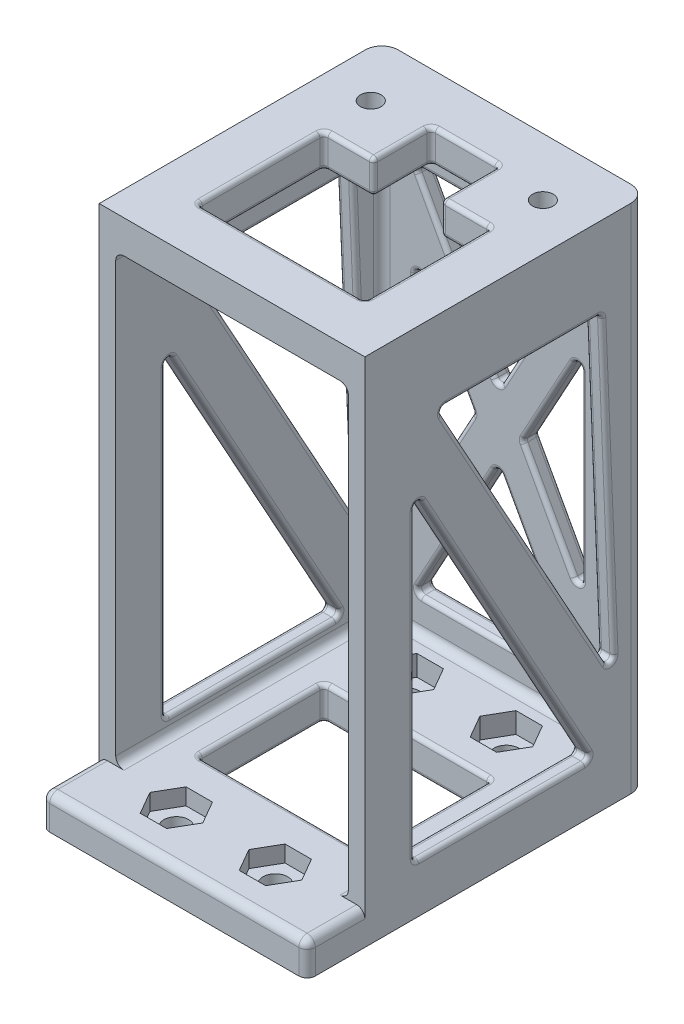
SolidWorks part; units mm, degrees
ref_plane "Front Plane" through (0, 0, 0) normal (0, 0, 1) x (1, 0, 0)
ref_plane "Top Plane" through (0, 0, 0) normal (0, 1, 0) x (1, 0, 0)
ref_plane "Right Plane" through (0, 0, 0) normal (1, 0, 0) x (0, 0, -1)
sketch "Sketch1" plane through (0, 0, 0) normal (0, 1, 0) x (1, 0, 0)
  line L1 (0, 0) -> (32.2, 0)
  line L2 (0, 0) -> (0, 34.25)
  line L3 (0, 34.25) -> (32.2, 34.25)
  line L4 (32.2, 0) -> (32.2, 34.25)
  dimension "D1" = 34.25
  dimension "D2" = 32.2
extrude "Boss-Extrude1" add sketch "Sketch1" along normal blind 4
sketch "Sketch2" plane through (0, 4, 0) normal (0, 1, 0) x (1, 0, 0)
  line L0 (32.2, 34.25) -> (0, 34.25) construction
  line L3 (16.1, 27.25) -> (10.1, 27.25) construction
  line L4 (16.1, 27.25) -> (22.1, 27.25) construction
  line L5 (16.1, 34.25) -> (16.1, 0) construction
  line L6 (0, 0) -> (32.2, 0) construction
  dimension "D1" = 6
  dimension "D2" = 7
ref_plane "Plane1" through (0, 58, 0) normal (0, 1, 0) x (1, 0, 0)
sketch "Sketch5" plane through (0, 58, 0) normal (0, 1, 0) x (1, 0, 0)
  line L1 (0, 34.25) -> (32.2, 34.25)
  line L2 (0, 34.25) -> (0, 0)
  line L3 (0, 0) -> (32.2, 0)
  line L4 (32.2, 34.25) -> (32.2, 0)
  dimension "D1" = 34.25
extrude "Boss-Extrude2" add sketch "Sketch5" along normal blind 4 separate body
sketch "Sketch6" plane through (0, 62, 0) normal (0, 1, 0) x (1, 0, 0)
  line L0 (16.1, 34.25) -> (16.1, 0) construction
  line L1 (32.2, 34.25) -> (0, 34.25) construction
  line L2 (0, 0) -> (32.2, 0) construction
  line L3 (16.1, 27.25) -> (5.67, 27.25) construction
  line L4 (16.1, 27.25) -> (26.53, 27.25) construction
  dimension "D1" = 10.43
  dimension "D2" = 7
sketch "Sketch11" plane through (0, 0, 0) normal (-1, 0, 0) x (0, 0, 1)
  line L0 (-34.25, 4) -> (-34.25, 58)
  line L1 (-34.25, 58) -> (0, 58)
  line L2 (0, 58) -> (0, 4)
  line L3 (0, 4) -> (-34.25, 4)
  line L4 (-34.25, 31) -> (0, 31) construction
extrude "Boss-Extrude3" add sketch "Sketch11" against normal blind 2
sketch "Sketch13" plane through (0, 0, 0) normal (-1, 0, 0) x (0, 0, 1)
  line L0 (-28.6924, 52) -> (-8.9515, 52)
  line L1 (-6, 44.9345) -> (-6, 6)
  line L2 (-6, 6) -> (-27.5082, 6)
  line L5 (-34.25, 62) -> (0, 62) construction
  line L6 (0, 62) -> (0, 0) construction
  line L7 (-34.25, 0) -> (0, 0) construction
  line L8 (17.71, 58) -> (-17.71, 58) construction
  line L9 (-30.2834, 13.3846) -> (-8.9515, 52)
  line L10 (-6, 44.9345) -> (-27.5082, 6)
  line L11 (0, 62) -> (-34.25, 0) construction
  line L12 (-30.2834, 13.3846) -> (-28.6924, 52)
  dimension "D1" = 6
  dimension "D2" = 6
  dimension "D4" = 6
  dimension "D5" = 3
  dimension "D6" = 3
extrude "Cut-Extrude1" cut sketch "Sketch13" against normal up to next
pattern_linear "LPattern1" count 2 spacing 30.2 along (1, 0, 0) of "Boss-Extrude3", "Cut-Extrude1"
sketch "Sketch16" plane through (0, 62, 0) normal (0, 1, 0) x (1, 0, 0)
  line L0 (12, 21.25) -> (6, 21.25)
  line L1 (26.2, 6) -> (6, 6)
  line L2 (26.2, 6) -> (26.2, 21.25)
  line L3 (26.2, 21.25) -> (20.2, 21.25)
  line L4 (6, 6) -> (6, 21.25)
  line L6 (20.2, 21.25) -> (20.2, 28.25)
  line L7 (20.2, 28.25) -> (12, 28.25)
  line L8 (12, 21.25) -> (12, 28.25)
  line L9 (32.2, 0) -> (32.2, 34.25) construction
  line L10 (0, 0) -> (32.2, 0) construction
  line L11 (0, 34.25) -> (0, 0) construction
  line L13 (32.2, 34.25) -> (0, 34.25) construction
  dimension "D1" = 6
  dimension "D2" = 6
  dimension "D3" = 6
  dimension "D4" = 6
  dimension "D5" = 6
  dimension "D6" = 6
  dimension "D7" = 6
  dimension "D8" = 6
extrude "Cut-Extrude3" cut sketch "Sketch16" against normal up to next
sketch "Sketch17" plane through (0, 0, 0) normal (0, -1, 0) x (1, 0, 0)
  line L0 (16.1, -21.25) -> (6, -21.25)
  line L1 (26.2, -6) -> (6, -6)
  line L2 (26.2, -6) -> (26.2, -21.25)
  line L3 (26.2, -21.25) -> (16.1, -21.25)
  line L4 (6, -6) -> (6, -21.25)
  line L9 (0, 0) -> (32.2, 0) construction
  line L10 (32.2, 0) -> (32.2, -34.25) construction
  line L11 (0, -34.25) -> (0, 0) construction
  line L13 (32.2, -34.25) -> (0, -34.25) construction
  dimension "D1" = 6
  dimension "D2" = 6
  dimension "D3" = 6
  dimension "D4" = 13
extrude "Cut-Extrude4" cut sketch "Sketch17" against normal up to next
sketch "Sketch18" plane through (2, 0, 0) normal (1, 0, 0) x (0, 0, -1)
  line L0 (34.25, 4) -> (32.25, 4)
  line L1 (34.25, 4) -> (0, 4) construction
  line L2 (32.25, 4) -> (32.25, 58)
  line L3 (0, 58) -> (34.25, 58) construction
  line L4 (32.25, 58) -> (34.25, 58)
  line L5 (34.25, 58) -> (34.25, 4)
  dimension "D1" = 2
extrude "Boss-Extrude5" add sketch "Sketch18" along normal up to next
sketch "Sketch19" plane through (0, 0, -34.25) normal (0, 0, -1) x (-1, 0, 0)
  line L0 (-16.1, 54.8836) -> (-16.1, 0.6881) construction
  line L3 (-32.2, 30.4346) -> (0, 30.4346) construction
  line L4 (-32.2, 62) -> (-32.2, 0) construction
  line L5 (0, 62) -> (0, 0) construction
  line L6 (-26.2, 52.8692) -> (-6, 52.8692)
  line L7 (-16.1, 52.8692) -> (-16.1, 34.4346) construction
  line L8 (-16.1, 34.4346) -> (-26.2, 52.8692)
  line L9 (-32.2, 62) -> (0, 62) construction
  line L10 (-16.1, 34.4346) -> (-6, 52.8692)
  line L11 (-16.1, 26.4346) -> (-26.2, 8)
  line L12 (-26.2, 8) -> (-6, 8)
  line L13 (-16.1, 26.4346) -> (-6, 8)
  line L14 (-6, 43.3984) -> (-6, 17.4708)
  line L15 (-6, 43.3984) -> (-13.1026, 30.4346)
  line L16 (-6, 17.4708) -> (-13.1026, 30.4346)
  line L17 (-26.2, 43.3984) -> (-19.0974, 30.4346)
  line L18 (-26.2, 17.4708) -> (-19.0974, 30.4346)
  line L19 (-26.2, 43.3984) -> (-26.2, 17.4708)
  line L21 (-30.2, 4) -> (-2, 4) construction
  line L22 (0, 62) -> (0, 0) construction
  line L23 (-32.2, 0) -> (0, 0) construction
  point P24 (-16.1, 27.7858)
  point P26 (-6, 30.4346)
  dimension "D1" = 6
  dimension "D2" = 9.1308
  dimension "D3" = 6
  dimension "D4" = 4
  dimension "D5" = 4
  dimension "D6" = 4
  dimension "D7" = 0.6881
  dimension "D8" = 7.1164
  dimension "D9" = 16.1
extrude "Cut-Extrude5" cut sketch "Sketch19" against normal up to next
fillet "Fillet9" radius 0.5 108 edges at (26.2, 62, -13.625) (26.2, 58, -13.625) (6, 58, -13.625) (6, 62, -13.625) (12, 58, -24.75) (12, 62, -24.75) (20.2, 62, -24.75) (20.2, 58, -24.75) (26.2, 4, -13.625) (26.2, 0, -13.625) (6, 0, -13.625) (6, 4, -13.625) (2, 6, -16.7541) (0, 6, -16.7541) (0, 25.4672, -6) (2, 25.4672, -6) (2, 52, -18.822) (0, 52, -18.822) (0, 32.6923, -29.4879) (2, 32.6923, -29.4879) (32.2, 6, -16.7541) (30.2, 6, -16.7541) (30.2, 25.4672, -6) (32.2, 25.4672, -6) (32.2, 52, -18.822) (30.2, 52, -18.822) (30.2, 32.6923, -29.4879) (32.2, 32.6923, -29.4879) (22.6487, 23.9527, -32.25) (22.6487, 23.9527, -34.25) (22.6487, 36.9165, -34.25) (22.6487, 36.9165, -32.25) (9.5513, 36.9165, -32.25) (9.5513, 36.9165, -34.25) (9.5513, 23.9527, -34.25) (9.5513, 23.9527, -32.25) (21.15, 43.6519, -32.25) (21.15, 43.6519, -34.25) (11.05, 43.6519, -34.25) (11.05, 43.6519, -32.25) (11.05, 17.2173, -32.25) (11.05, 17.2173, -34.25) (21.15, 17.2173, -34.25) (21.15, 17.2173, -32.25) (26.2, 60, -6) (16.1, 62, -6) (6, 60, -6) (16.1, 58, -6) (20.2, 60, -21.25) (23.2, 62, -21.25) (26.2, 60, -21.25) (23.2, 58, -21.25) (6, 60, -21.25) (9, 62, -21.25) (12, 60, -21.25) (9, 58, -21.25) (12, 60, -28.25) (16.1, 62, -28.25) (20.2, 60, -28.25) (16.1, 58, -28.25) (6, 2, -6) (16.1, 0, -6) (26.2, 2, -6) (16.1, 4, -6) (26.2, 2, -21.25) (16.1, 0, -21.25) (16.1, 4, -21.25) (6, 2, -21.25) (1, 6, -27.5082) (0, 25.4672, -16.7541) (1, 44.9345, -6) (2, 25.4672, -16.7541) (1, 52, -8.9515) (0, 32.6923, -19.6175) (1, 13.3846, -30.2834) (2, 32.6923, -19.6175) (31.2, 6, -27.5082) (30.2, 25.4672, -16.7541) (31.2, 44.9345, -6) (32.2, 25.4672, -16.7541) (31.2, 52, -8.9515) (30.2, 32.6923, -19.6175) (31.2, 13.3846, -30.2834) (32.2, 32.6923, -19.6175) (26.2, 17.4708, -33.25) (26.2, 30.4346, -34.25) (26.2, 43.3984, -33.25) (26.2, 30.4346, -32.25) (6, 43.3984, -33.25) (6, 30.4346, -34.25) (6, 17.4708, -33.25) (6, 30.4346, -32.25) (26.2, 52.8692, -33.25) (16.1, 52.8692, -34.25) (6, 52.8692, -33.25) (16.1, 52.8692, -32.25) (6, 8, -33.25) (16.1, 8, -34.25) (26.2, 8, -33.25) (16.1, 8, -32.25) (1, 6, -6) (1, 52, -28.6924) (31.2, 6, -6) (31.2, 52, -28.6924) (19.0974, 30.4346, -33.25) (13.1026, 30.4346, -33.25) (16.1, 26.4346, -33.25) (16.1, 34.4346, -33.25)
fillet "Fillet10" radius 1 8 edges at (30.2, 58, -16.125) (2, 58, -16.125) (16.1, 58, -32.25) (30.2, 4, -16.125) (30.2, 31, -32.25) (2, 31, -32.25) (2, 4, -16.125) (16.1, 4, -32.25)
fillet "Fillet11" radius 2 2 edges at (32.2, 31, -34.25) (0, 31, -34.25)
sketch "Sketch20" plane through (0, 4, 0) normal (0, 1, 0) x (1, 0, 0)
  circle A0 centre (10.1, 27.25) radius 1.5
  circle A1 centre (22.1, 27.25) radius 1.5
  dimension "D1" = 3
extrude "Cut-Extrude6" cut sketch "Sketch20" against normal blind 10
sketch "Sketch21" plane through (0, 62, 0) normal (0, 1, 0) x (1, 0, 0)
  circle A0 centre (5.67, 27.25) radius 1.25
  circle A1 centre (26.53, 27.25) radius 1.25
  dimension "D1" = 2.5
extrude "Cut-Extrude7" cut sketch "Sketch21" against normal up to next
sketch "Sketch22" plane through (0, 4, 0) normal (0, 1, 0) x (1, 0, 0)
  line L1 (13.3043, 27.25) -> (11.7021, 30.025)
  line L2 (11.7021, 30.025) -> (8.4979, 30.025)
  line L3 (8.4979, 30.025) -> (6.8957, 27.25)
  line L4 (6.8957, 27.25) -> (8.4979, 24.475)
  line L5 (8.4979, 24.475) -> (11.7021, 24.475)
  line L6 (11.7021, 24.475) -> (13.3043, 27.25)
  line L7 (18.8957, 27.25) -> (20.4979, 24.475)
  line L8 (20.4979, 24.475) -> (23.7021, 24.475)
  line L9 (23.7021, 24.475) -> (25.3043, 27.25)
  line L10 (25.3043, 27.25) -> (23.7021, 30.025)
  line L11 (23.7021, 30.025) -> (20.4979, 30.025)
  line L12 (20.4979, 30.025) -> (18.8957, 27.25)
  line L13 (30.2, 34.25) -> (2, 34.25) construction
  circle A0 centre (10.1, 27.25) radius 2.775 construction
  circle A1 centre (22.1, 27.25) radius 2.775 construction
  dimension "D1" = 5.55
extrude "Cut-Extrude8" cut sketch "Sketch22" against normal blind 2.5
sketch "Sketch23" plane through (0, 0, -34.25) normal (0, 0, -1) x (-1, 0, 0)
  line L0 (-16.1, 0) -> (-16.1, 7.5) construction
  line L1 (-30.2, 0) -> (-2, 0) construction
  line L2 (-6.8441, 7.5) -> (-25.3559, 7.5) construction
sketch "Sketch24" plane through (0, 0, 0) normal (0, -1, 0) x (1, 0, 0)
  line L3 (0, 0) -> (32.2, 0)
  line L4 (0, 0) -> (0, 7)
  line L5 (0, 7) -> (32.2, 7)
  line L6 (32.2, 0) -> (32.2, 7)
  dimension "D2" = 7
extrude "Boss-Extrude6" add sketch "Sketch24" against normal blind 4
sketch "Sketch25" plane through (0, 0, 0) normal (0, -1, 0) x (1, 0, 0)
  line L0 (10.1, -27.25) -> (10.1, 0.75) construction
  line L1 (22.1, -27.25) -> (22.1, 0.75) construction
  circle A0 centre (10.1, 0.75) radius 1.5
  circle A1 centre (22.1, 0.75) radius 1.5
  circle A2 centre (22.1, -27.25) radius 1.5 construction
  dimension "D1" = 28
extrude "Cut-Extrude9" cut sketch "Sketch25" against normal up to next
sketch "Sketch26" plane through (0, 4, 0) normal (0, 1, 0) x (1, 0, 0)
  line L0 (32.2, -7) -> (0, -7) construction
  line L1 (13.3043, -0.75) -> (11.7021, 2.025)
  line L2 (11.7021, 2.025) -> (8.4979, 2.025)
  line L3 (8.4979, 2.025) -> (6.8957, -0.75)
  line L4 (6.8957, -0.75) -> (8.4979, -3.525)
  line L5 (8.4979, -3.525) -> (11.7021, -3.525)
  line L6 (11.7021, -3.525) -> (13.3043, -0.75)
  line L7 (25.3043, -0.75) -> (23.7021, 2.025)
  line L8 (23.7021, 2.025) -> (20.4979, 2.025)
  line L9 (20.4979, 2.025) -> (18.8957, -0.75)
  line L10 (18.8957, -0.75) -> (20.4979, -3.525)
  line L11 (20.4979, -3.525) -> (23.7021, -3.525)
  line L12 (23.7021, -3.525) -> (25.3043, -0.75)
  circle A0 centre (10.1, -0.75) radius 2.775 construction
  circle A1 centre (22.1, -0.75) radius 2.775 construction
  dimension "D1" = 5.55
extrude "Cut-Extrude10" cut sketch "Sketch26" against normal blind 2
fillet "Fillet12" radius 1 5 edges at (32.2, 4, 3.5) (32.2, 2, 7) (0, 2, 7) (0, 4, 3.5) (16.1, 4, 7)
